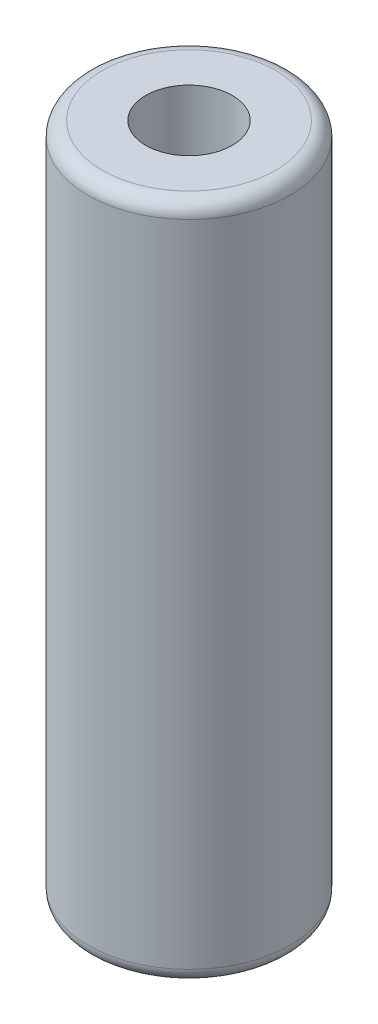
SolidWorks part; units mm, degrees
ref_plane "Спереди" through (0, 0, 0) normal (0, 0, 1) x (1, 0, 0)
ref_plane "Сверху" through (0, 0, 0) normal (0, 1, 0) x (1, 0, 0)
ref_plane "Справа" through (0, 0, 0) normal (1, 0, 0) x (0, 0, -1)
sketch "Эскиз1" plane through (0, 0, 0) normal (0, 1, 0) x (1, 0, 0)
  circle A0 centre (0, 0) radius 7
  dimension "D1" = 14
extrude "Бобышка-Вытянуть1" add sketch "Эскиз1" along normal blind 47
sketch "Эскиз3" plane through (0, 0, 0) normal (0, -1, 0) x (1, 0, 0)
  circle A0 centre (0, 0) radius 3
  dimension "D1" = 6
extrude "Вырез-Вытянуть1" cut sketch "Эскиз3" against normal through all
chamfer "Фаска1" distance 3 angle 45 1 edges at (0, 0, -3)
fillet "Скругление1" radius 1 2 edges at (0, 0, 7) (0, 47, 7)
